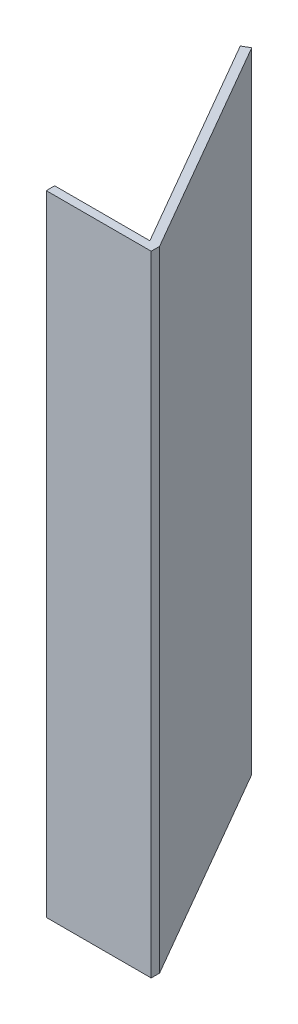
SolidWorks part; units mm, degrees
ref_plane "Спереди" through (0, 0, 0) normal (0, 0, 1) x (1, 0, 0)
ref_plane "Сверху" through (0, 0, 0) normal (0, 1, 0) x (1, 0, 0)
ref_plane "Справа" through (0, 0, 0) normal (1, 0, 0) x (0, 0, -1)
sketch "Эскиз1" plane through (0, 0, 0) normal (0, 1, 0) x (1, 0, 0)
  line L0 (0, 0) -> (25, 0)
  line L1 (25, 0) -> (25, 2)
  line L2 (25, 2) -> (-5, 53.9615)
  line L3 (-5, 53.9615) -> (-6.7321, 52.9615)
  line L4 (-6.7321, 52.9615) -> (22.6906, 2)
  line L5 (22.6906, 2) -> (0, 2)
  line L6 (0, 2) -> (0, 0)
  dimension "D1" = 2
  dimension "D2" = 2
  dimension "D3" = 25
  dimension "D4" = 60
  dimension "D5" = 60
extrude "Бобышка-Вытянуть1" add sketch "Эскиз1" along normal blind 150
